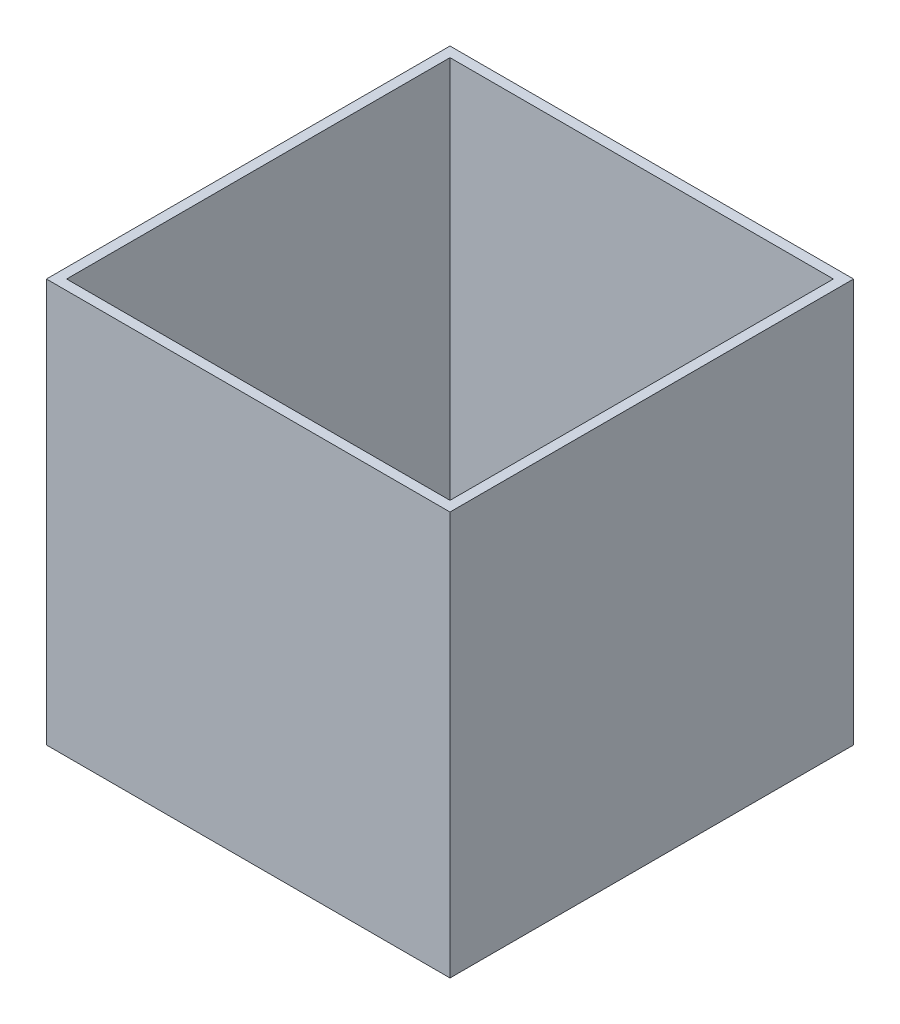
SolidWorks part; units mm, degrees
ref_plane "Front" through (0, 0, 0) normal (0, 0, 1) x (1, 0, 0)
ref_plane "Top" through (0, 0, 0) normal (0, 1, 0) x (1, 0, 0)
ref_plane "Right" through (0, 0, 0) normal (1, 0, 0) x (0, 0, -1)
sketch "Sketch1" plane through (0, 0, 0) normal (0, 1, 0) x (1, 0, 0)
  line L1 (0, 0) -> (101.6, 0)
  line L2 (0, 0) -> (0, 101.6)
  line L3 (0, 101.6) -> (101.6, 101.6)
  line L4 (101.6, 0) -> (101.6, 101.6)
  dimension "D1" = 101.6
extrude "Boss-Extrude1" add sketch "Sketch1" along normal blind 101.6 contours L2 L3 L4 L1
shell "Shell1" thickness 2.54
